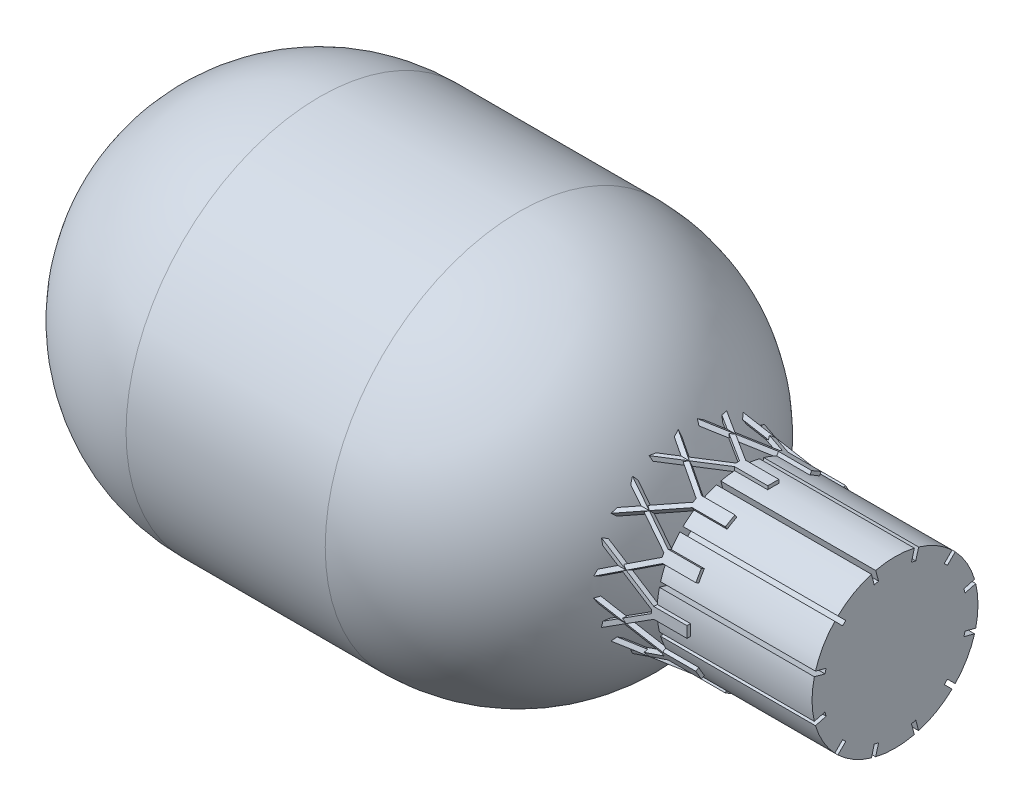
SolidWorks part; units mm, degrees
ref_plane "Plane1" through (0, 0, 0) normal (0, 0, 1) x (1, 0, 0)
ref_plane "Plane2" through (0, 0, 0) normal (0, 1, 0) x (1, 0, 0)
ref_plane "Plane3" through (0, 0, 0) normal (1, 0, 0) x (0, 0, -1)
ref_plane "Plan4" through (68, 0, 0) normal (1, 0, 0) x (0, 0, -1)
sketch "Esquisse3" plane through (0, 0, 0) normal (0, 0, 1) x (1, 0, 0)
  line L0 (31, 17.5) -> (49, 17.5)
  line L1 (66.3853, 2) -> (69, 2)
  line L3 (0, 0) -> (146.292, 0) construction
  line L6 (13.5, 0) -> (83, 0)
  line L7 (69, 2) -> (69, 7.5)
  line L8 (69, 7.5) -> (83, 7.5)
  line L9 (83, 7.5) -> (83, 0)
  arc A0 (31, 17.5) -> (13.5, 0) centre (31, 0) ccw
  arc A2 (66.3853, 2) -> (49, 17.5) centre (49, 0) ccw
  dimension "D1" = 31
  dimension "D2" = 18
  dimension "D3" = 17.5
  dimension "D4" = 14
  dimension "D5" = 20
  dimension "D6" = 2
  dimension "D7" = 7.5
revolve "Base-Révolution" add sketch "Esquisse3" angle 360 about L3
sketch "Esquisse4" plane through (68, 0, 0) normal (1, 0, 0) x (0, 0, -1)
  line L4 (0, 0) -> (-2.3756, 18.0446) construction
  line L5 (0, 0) -> (0, 17.5) construction
  line L6 (-2.3931, 8.1586) -> (-1.8755, 6.2268)
  line L7 (-2.3931, 8.1586) -> (-2.0068, 8.2621)
  line L8 (-1.4891, 6.3303) -> (-2.0068, 8.2621)
  line L9 (-1.4891, 6.3303) -> (-1.8755, 6.2268)
  dimension "D1" = 7.5
extrude "Enlèv. mat.-Extru.1" cut sketch "Esquisse4" along normal up to next
ref_plane "Plan5" through (0, 7.4, 0) normal (0, 1, 0) x (-1, 0, 0)
sketch "Esquisse5" plane through (-5, 7.4, 0) normal (0, 1, 0) x (-1, 0, 0)
  line L0 (-77, 0.5) -> (-74, 0.5)
  line L1 (-77, 0.5) -> (-77, -0.5)
  line L2 (-74, -0.5) -> (-77, -0.5)
  line L3 (-73.7852, 0.1625) -> (-73.7852, -0.1625)
  line L4 (-74, 0.5) -> (-68.5, 4)
  line L5 (-68.5, 4) -> (-68.2852, 3.6625)
  line L6 (-68.2852, 3.6625) -> (-73.7852, 0.1625)
  line L8 (-77, 0) -> (-70.5, 0) construction
  line L10 (-68.2852, -3.6625) -> (-73.7852, -0.1625)
  line L11 (-68.5, -4) -> (-68.2852, -3.6625)
  line L12 (-74, -0.5) -> (-68.5, -4)
  dimension "D1" = 0.4
extrude "Boss.-Extru.3" add sketch "Esquisse5" along normal blind 0.4
pattern_circular "Répétition circulaire1" count 12 every 30 about axis through (0, 0, 0) along (1, 0, 0)
